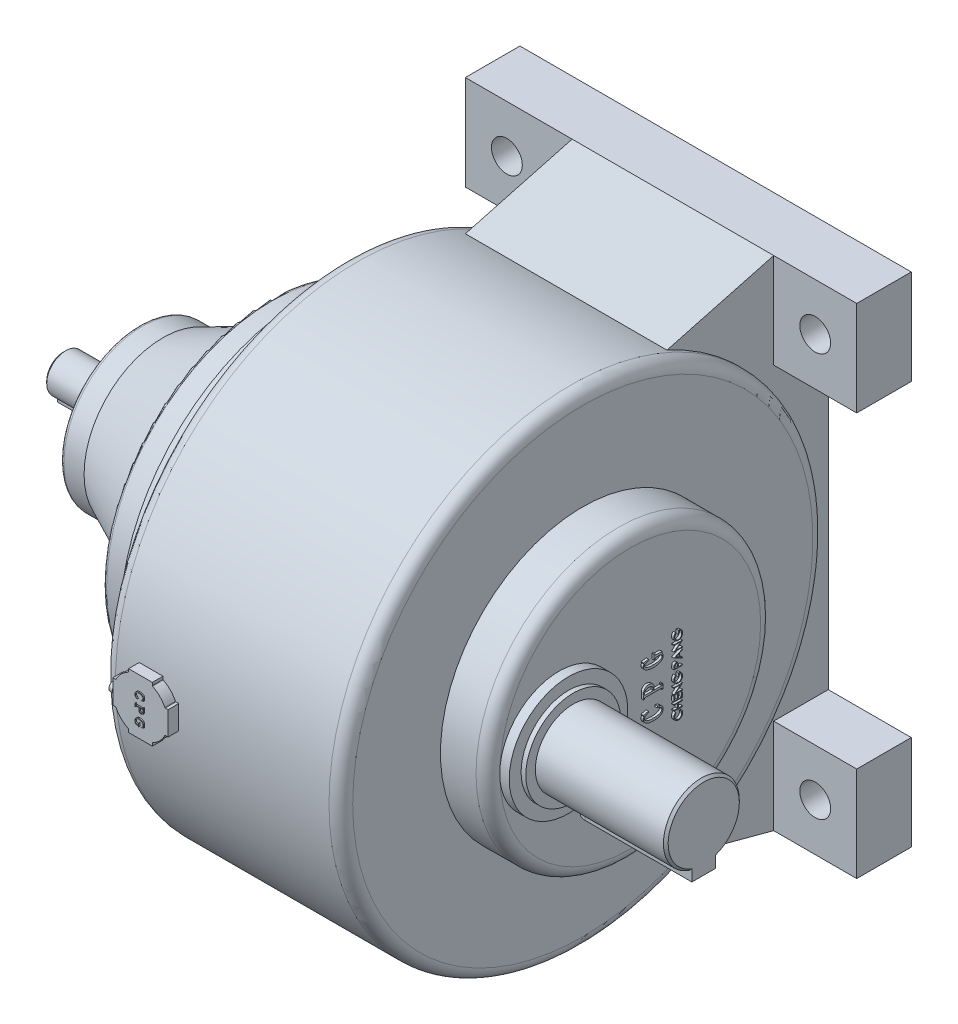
SolidWorks part; units mm, degrees
ref_plane "前视基准面" through (0, 0, 0) normal (0, 0, 1) x (1, 0, 0)
ref_plane "上视基准面" through (0, 0, 0) normal (0, 1, 0) x (1, 0, 0)
ref_plane "右视基准面" through (0, 0, 0) normal (1, 0, 0) x (0, 0, -1)
ref_plane "基准面1" through (0, 0, -140) normal (0, 0, 1) x (1, 0, 0)
sketch "草图1" plane through (0, 0, 0) normal (0, 1, 0) x (1, 0, 0)
  line L0 (0, 0) -> (33.1729, 0) construction
  line L1 (0, 0) -> (0, -16)
  line L2 (0, -16) -> (-55, -16)
  line L3 (-55, -16) -> (-55, -20)
  line L4 (-55, -20) -> (-57, -20)
  line L5 (-57, -20) -> (-57, -25)
  line L6 (-57, -25) -> (-61, -25)
  line L7 (-61, -25) -> (-61, 0)
  line L8 (-61, 0) -> (0, 0)
  dimension "D1" = 55
  dimension "D2" = 32
  dimension "D3" = 40
  dimension "D4" = 2
  dimension "D5" = 50
  dimension "D6" = 4
revolve "旋转1" add sketch "草图1" angle 360 about L0
sketch "草图2" plane through (0, 0, 0) normal (0, 1, 0) x (1, 0, 0)
  line L0 (8.0167, 30) -> (-61, 30) construction
  line L1 (-61, 30) -> (-61, -30)
  line L2 (-61, 25) -> (-61, -25) construction
  line L3 (-61, -30) -> (-81, -30)
  line L4 (-81, -30) -> (-81, -72)
  line L5 (-81, -72) -> (-181, -72)
  line L6 (-181, -72) -> (-181, 30)
  line L11 (-61, 30) -> (-181, 30)
  line L13 (-103.125, 140) -> (103.125, 140) construction
  dimension "D1" = 30
  dimension "D2" = 120
  dimension "D3" = 20
  dimension "D4" = 212
  dimension "D5" = 100
revolve "旋转2" add sketch "草图2" angle 360 about L0
sketch "草图3" plane through (0, 0, -140) normal (0, 0, 1) x (1, 0, 0)
  line L0 (0, 0) -> (40.0459, 0) construction
  line L1 (-217.5, -65) -> (-52.5, -65)
  line L2 (-217.5, -65) -> (-217.5, -105)
  line L3 (-217.5, -105) -> (-52.5, -105)
  line L4 (-52.5, -65) -> (-52.5, -105)
  line L5 (0, -16) -> (0, 16) construction
  circle A0 centre (-70, -85) radius 6.5
  circle A1 centre (-200, -85) radius 6.5
  dimension "D2" = 170
  dimension "D3" = 13
  dimension "D4" = 130
  dimension "D6" = 70
  dimension "D8" = 40
  dimension "D1" = 210
  dimension "D5" = 165
  dimension "D7" = 17.5
extrude "拉伸2" add sketch "草图3" along normal blind 23
mirror "镜向2" about plane through (0, 0, 0) normal (0, 1, 0)
ref_plane "基准面4" through (-130, 0, 0) normal (1, 0, 0) x (0, 0, -1)
sketch "草图4" plane through (-130, 0, 0) normal (1, 0, 0) x (0, 0, -1)
  line L0 (117, 65) -> (140, 65) construction
  line L1 (117, 65) -> (140, 65)
  line L2 (117, 105) -> (117, 65) construction
  line L3 (117, 105) -> (117, 65)
  line L4 (117, -65) -> (140, -65) construction
  line L5 (117, -65) -> (140, -65)
  line L6 (117, -105) -> (117, -65) construction
  line L7 (117, -105) -> (117, -65)
  line L8 (140, 65) -> (140, -65)
  line L9 (117, 105) -> (72, 92.9516)
  line L11 (72, -92.9516) -> (117, -105)
  arc A1 (72, -92.9516) -> (72, 92.9516) centre (30, 0) ccw
  circle A2 centre (30, 0) radius 102 construction
  dimension "D1" = 45
extrude "拉伸3" add sketch "草图4" against normal mid plane 85
sketch "草图5" plane through (0, 0, 0) normal (0, 1, 0) x (1, 0, 0)
  line L0 (0, -5) -> (-45, -5)
  line L1 (0, -16) -> (0, 16) construction
  line L2 (-45, 5) -> (0, 5)
  line L3 (0, 5) -> (0, -5)
  line L4 (35.5, -13.7955) -> (35.5, 19.6443) construction
  arc A0 (-45, -5) -> (-45, 5) centre (-45, 0) cw
  dimension "D2" = 50
  dimension "D1" = 10
  dimension "D3" = 35.5
extrude "拉伸4" add sketch "草图5" against normal blind 19
fillet "圆角1" radius 5 3 edges at (-181, 0, -132) (-81, 0, -132) (-61, 0, -90)
chamfer "倒角1" distance 1 angle 45 1 edges at (0, 16, 0)
sketch "草圖2"
extrude "伸長1" add sketch "草圖2" along normal blind 1
sketch "草圖3" plane through (0, 0, 0) normal (0, 1, 0) x (1, 0, 0)
  line L0 (-269.0797, 30) -> (-111.2984, 30) construction
  line L1 (-181, 30) -> (-300, 30)
  line L2 (-197.5, 99.75) -> (-212, 99.75)
  line L5 (-213.5, 83.75) -> (-258, 63.25)
  line L6 (-271.5, 38) -> (-271.5, 37.95)
  line L8 (-197, 109.05) -> (-181, 109.05)
  line L9 (-266.5, 63.25) -> (-258, 63.25)
  line L10 (-213.5, 98.25) -> (-213.5, 83.75)
  line L11 (-271.5, 38) -> (-299, 38)
  line L12 (-270, 37.95) -> (-271.5, 37.95)
  line L13 (-269.5, 39.75) -> (-270, 39.45)
  line L14 (-300, 30) -> (-300, 37)
  line L15 (-300, 37) -> (-299, 38)
  line L16 (-268, 39.75) -> (-269.5, 39.75)
  line L17 (-181, 127) -> (-181, -67) construction
  line L18 (-197, 109.05) -> (-197, 99.25)
  line L19 (-270, 39.45) -> (-270, 37.95)
  line L20 (-268, 39.75) -> (-268, 61.75)
  line L21 (-181, 109.05) -> (-181, 30)
  arc A0 (-197, 99.25) -> (-197.5, 99.75) centre (-197.5, 99.25) ccw
  arc A1 (-197, 99.25) -> (-197.5, 99.75) centre (-197.5, 99.25) ccw
  arc A2 (-266.5, 63.25) -> (-268, 61.75) centre (-266.5, 61.75) ccw
  arc A3 (-212, 99.75) -> (-213.5, 98.25) centre (-212, 98.25) ccw
  dimension "D2" = 16
  dimension "D3" = 30
  dimension "D5" = 139.5
  dimension "D6" = 103
revolve "旋轉1" add sketch "草圖3" angle 360 about L0
sketch "草圖4" plane through (0, 0, 0) normal (0, 1, 0) x (1, 0, 0)
  line L0 (-300, 27.5) -> (-275.5, 27.5)
  line L1 (-271.5, 38) -> (-299, 38) construction
  line L2 (-275.5, 32.5) -> (-300, 32.5)
  line L3 (-300, 32.5) -> (-300, 27.5)
  line L4 (-315.9982, 30) -> (-262.1996, 30) construction
  line L5 (-273, 30) -> (-273, 14.3204) construction
  arc A0 (-275.5, 27.5) -> (-275.5, 32.5) centre (-275.5, 30) ccw
  dimension "D1" = 2.5
  dimension "D2" = 27
  dimension "D3" = 5
  dimension "D4" = 8
extrude "伸長2" add sketch "草圖4" against normal blind 10
ref_plane "平面1" through (0, 0, 76.5) normal (0, 0, 1) x (1, 0, 0)
sketch "草圖5" plane through (0, 0, 76.5) normal (0, 0, 1) x (1, 0, 0)
  line L0 (-166, 11.65) -> (-156, 11.65)
  line L1 (-166, 11.65) -> (-166, 10.5119)
  line L2 (-156, 11.65) -> (-156, 10.5119)
  line L3 (-166, -10.5119) -> (-166, -11.65)
  line L4 (-156, -10.5119) -> (-156, -11.65)
  line L5 (-172.65, 5) -> (-171.5119, 5)
  line L6 (-172.65, -5) -> (-171.5119, -5)
  line L7 (-172.65, -5) -> (-172.65, 5)
  line L8 (-166, -11.65) -> (-166, -10.5119)
  line L9 (-156, -11.65) -> (-156, -10.5119)
  line L10 (-156, -11.65) -> (-166, -11.65)
  line L11 (-149.35, -5) -> (-150.4881, -5)
  line L12 (-149.35, 5) -> (-150.4881, 5)
  line L13 (-149.35, 5) -> (-149.35, -5)
  arc A0 (-166.1383, 10.2882) -> (-171.2882, 5.1383) centre (-161, 0) ccw
  arc A1 (-166.1383, 10.2882) -> (-166, 10.5119) centre (-166.25, 10.5119) ccw
  arc A2 (-156, 10.5119) -> (-155.8617, 10.2882) centre (-155.75, 10.5119) ccw
  arc A3 (-171.5119, 5) -> (-171.2882, 5.1383) centre (-171.5119, 5.25) ccw
  arc A4 (-171.2882, -5.1383) -> (-171.5119, -5) centre (-171.5119, -5.25) ccw
  arc A5 (-166, -10.5119) -> (-166.1383, -10.2882) centre (-166.25, -10.5119) ccw
  arc A6 (-155.8617, -10.2882) -> (-156, -10.5119) centre (-155.75, -10.5119) ccw
  arc A7 (-150.4881, -5) -> (-150.7118, -5.1383) centre (-150.4881, -5.25) ccw
  arc A8 (-150.7118, 5.1383) -> (-150.4881, 5) centre (-150.4881, 5.25) ccw
  arc A9 (-150.7118, 5.1383) -> (-155.8617, 10.2882) centre (-161, 0) ccw
  arc A10 (-171.2882, -5.1383) -> (-166.1383, -10.2882) centre (-161, 0) ccw
  arc A11 (-155.8617, -10.2882) -> (-150.7118, -5.1383) centre (-161, 0) ccw
  dimension "D1" = 11.5
extrude "伸長3" add sketch "草圖5" against normal blind 4.5 separate body contours A6 A11 A7 L11 L13 L12 A8 A9 A2 L2 L0 L1 A1 A0 A3 L5 L7 L6 A4 A10 A5 L3 L10 L4
sketch "草圖6"
extrude "伸長4" add sketch "草圖6" along normal blind 0.5
sketch "草圖7" plane through (0, 0, 0) normal (0, 1, 0) x (1, 0, 0)
  line L0 (-174.5404, -74.25) -> (-166.5404, -74.25)
  line L1 (-174.5404, -74.25) -> (-174.5404, -72.25)
  line L2 (-173.0404, -73) -> (-173.0404, -72.25)
  line L13 (-171.0404, -73) -> (-166.5404, -73.25)
  line L15 (-173.0404, -73) -> (-171.0404, -73)
  line L23 (-174.5404, -72.25) -> (-173.0404, -72.25)
  line L24 (-171.0404, -74.25) -> (-171.0404, -73)
  line L25 (-166.5404, -74.25) -> (-166.5404, -73.25)
revolve "旋轉2" add sketch "草圖7" angle 360 about L0
equation "\"D7@草图3\" =  ( \"D5@草图3\"-\"D4@草图3\"  )  / 2"
equation "\"D8@草图3\" =  \"D1@草图3\"-\"D2@草图3\""
equation "\"D1@拉伸4\" =\"D3@草图5\"-\"D2@草图1\"/2"
equation "\"D3@草图1\" = \"D2@草图1\"+8"
equation "\"D5@草图2\" = \"D4@草图3\"-30"
equation "\"D1@基准面4\" =\"D5@草图3\"/2-5"
equation "\"D1@拉伸3\" = \"D4@草图3\"-\"D3@草图3\" - 32"
